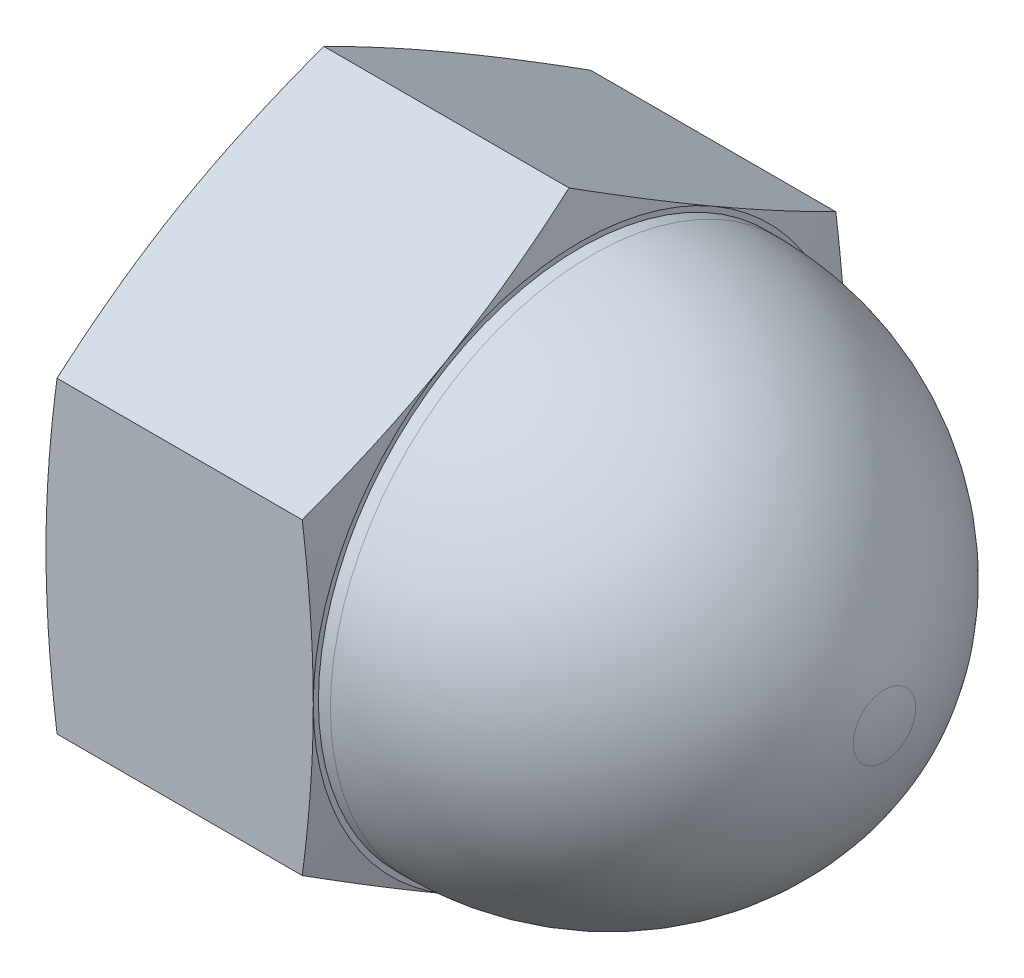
SolidWorks part; units mm, degrees
ref_plane "Plane1" through (0, 0, 0) normal (0, 0, 1) x (1, 0, 0)
ref_plane "Plane2" through (0, 0, 0) normal (0, 1, 0) x (1, 0, 0)
ref_plane "Plane3" through (0, 0, 0) normal (1, 0, 0) x (0, 0, -1)
sketch "BaseNutSke" plane through (0, 0, 0) normal (1, 0, 0) x (0, 0, -1)
  line L6 (18.2562, 10.5403) -> (18.2562, -10.5403)
  line L7 (-18.2562, 10.5403) -> (-18.2563, -10.5403)
  line L8 (18.2562, 10.5403) -> (0, 21.0805)
  line L9 (0, 21.0805) -> (-18.2562, 10.5403)
  line L10 (-18.2563, -10.5403) -> (0, -21.0805)
  line L11 (0, -21.0805) -> (18.2562, -10.5403)
  dimension "D4" = 60
  dimension "D1" = 120
  dimension "D2" = 18.2562
  dimension "D3" = 18.2562
  dimension "Width_flats" = 36.5125
extrude "BaseNut" add sketch "BaseNutSke" along normal blind 18.288
sketch "Sketch3" plane through (0, 0, 0) normal (0, 0, 1) x (1, 0, 0)
  line L0 (0, 0) -> (63.5, 0) construction
  line L1 (0, 10.5403) -> (0, -10.5403) construction
  line L2 (39.37, 0) -> (0, 0)
  line L3 (0, 17.907) -> (19.1115, 17.907)
  line L4 (0, -17.907) -> (22.225, -17.907) construction
  line L5 (0, 17.907) -> (0, 0)
  arc A0 (39.37, 0) -> (39.1176, 2.1336) centre (30.226, 0) ccw
  arc A1 (39.1176, 2.1336) -> (19.1115, 17.907) centre (19.1115, -2.667) ccw
  dimension "Nose_radius" = 9.144
  dimension "Body_radius" = 20.574
  dimension "Overall_ht" = 39.37
  dimension "Body_dia" = 35.814
revolve "Crown" add sketch "Sketch3" angle 360 about L0
sketch "Sketch4" plane through (0, 0, 0) normal (0, 0, 1) x (1, 0, 0)
  line L0 (0, 18.2562) -> (1.9554, 25.554)
  line L1 (18.288, 18.2562) -> (16.3329, 25.554)
  line L2 (1.9554, 25.554) -> (16.3329, 25.554)
  line L3 (18.288, 18.2562) -> (30.988, 18.2562)
  line L4 (30.988, 18.2562) -> (30.988, 43.6562)
  line L5 (30.988, 43.6562) -> (-12.7, 43.6562)
  line L6 (0, 18.2562) -> (-12.7, 18.2562)
  line L7 (-12.7, 18.2562) -> (-12.7, 43.6562)
  line L8 (18.288, 21.0805) -> (18.288, 10.5403) construction
  line L9 (0, 21.0805) -> (0, 10.5403) construction
  line L10 (0, 0) -> (57.15, 0) construction
  line L11 (18.288, 21.0805) -> (0, 21.0805) construction
  point P17 (18.288, 18.2562)
  dimension "D1" = 14.997
  dimension "D2" = 15
  dimension "D3" = 12.7
  dimension "D4" = 12.7
  dimension "D5" = 4.4735
  dimension "D6" = 25.4
  dimension "D7" = 18.2562
revolve "DoubleChamfer" cut sketch "Sketch4" angle 360 about L10
sketch "Sketch5" plane through (0, 0, 0) normal (0, 0, 1) x (1, 0, 0)
  line L0 (0, 0) -> (44.45, 0) construction
  line L1 (0, 11.1125) -> (28.448, 11.1125)
  line L2 (0, 15.8104) -> (0, 0) construction
  line L3 (28.448, 11.1125) -> (35.1251, 0)
  line L4 (0, 0) -> (63.5, 0) construction
  line L5 (35.1251, 0) -> (0, 0)
  line L6 (0, 0) -> (0, 11.1125)
  line L7 (28.448, -11.1125) -> (35.1251, 0) construction
  line L8 (0, -11.1125) -> (28.448, -11.1125) construction
  dimension "TPA" = 118
  dimension "Thread_min" = 22.225
  dimension "Drill_depth" = 28.448
revolve "TapDrill" cut sketch "Sketch5"
pattern_linear "ThdSchPat" [suppressed]
revolve "ThreadSchematic" cut sketch "ThdSchSke" angle 360 about L0
sketch "ThdSchSke" plane through (0, 0, 0) normal (0, 1, 0) x (1, 0, 0)
  line L0 (0.0381, 12.7) -> (-1.0735, 11.1125)
  line L1 (-1.0735, 11.1125) -> (-1.0735, 5.5563)
  line L2 (-1.0735, 5.5563) -> (1.1497, 5.5562)
  line L3 (1.1497, 5.5562) -> (1.1497, 11.1125)
  line L4 (1.1497, 11.1125) -> (0.0381, 12.7)
  line L5 (-38.1, 0) -> (3.175, 0) construction
  line L6 (0, 0) -> (-15.875, 0) construction
  line L7 (0, 0) -> (63.5, 0) construction
  line L9 (3.2131, 3.175) -> (3.2131, -3.175) construction
  dimension "D1" = 360
  dimension "VeeAngle" = 70
  dimension "SideAngle" = 55
  dimension "Thread_major" = 25.4
  dimension "Tap_drill" = 22.225
  dimension "OverCut" = 11.1125
  dimension "D2" = 1
  dimension "Advance" = 3.0395
  dimension "Num_threads" = 7
  dimension "D4" = 50
  dimension "Thread_depth" = 25.4
  dimension "Thread_nominal" = 25.4
sketch "EndChamferSketch" plane through (0, 0, 0) normal (0, 0, 1) x (1, 0, 0)
  line L0 (-0.0254, 12.7) -> (0.0254, 12.7)
  line L1 (0.0254, 12.7) -> (1.2481, 10.9538)
  line L2 (1.2481, 10.9538) -> (-0.0254, 10.9538)
  line L3 (-0.0254, 10.9538) -> (-0.0254, 12.7)
  line L4 (0, 0) -> (-15.875, 0) construction
  dimension "D1" = 0.0508
  dimension "D2" = 35
  dimension "D3" = 0.0254
  dimension "ChamferDepth" = 1.7463
  dimension "ThreadMajor" = 12.7
revolve "EndChamfer" cut sketch "EndChamferSketch" angle 360 about L4
equation "\"D2@BaseNutSke\" = \"Width_flats@BaseNutSke\" / 2"
equation "\"D3@BaseNutSke\" = \"Width_flats@BaseNutSke\" / 2"
equation "\"D7@Sketch4\" = \"Width_flats@BaseNutSke\" / 2"
equation "\"Thread_major@ThdSchSke\" = \"Thread_nominal@ThreadCosmetic\""
equation "\"Tap_drill@ThdSchSke\" = \"Thread_min@Sketch5\""
equation "\"Overcut@ThdSchSke\" = \"Tap_drill@ThdSchSke\" * 0.5"
equation "\"Num_threads@ThdSchPat\" = int(  ( \"Hex_ht@BaseNut\" - 0.002 ) / \"Advance@ThdSchSke\" + 0.999 )  + 1"
equation "\"Advance@ThdSchPat\" = ( \"Hex_ht@BaseNut\" - 0.002 ) /  (\"Num_threads@ThdSchPat\" - 1) 'relax it"
equation "' \"Num_threads@ThdSchPat\" = \"Num_threads@ThdSchPat\" - sgn( \"Num_threads@ThdSchPat\" - 1) '---chamfered tips only---"
equation "\"ThreadMajor@EndChamferSketch\" = \"Thread_nominal@ThreadCosmetic\" * 0.5"
equation "\"ChamferDepth@EndChamferSketch\" = (\"Thread_nominal@ThreadCosmetic\" - \"Thread_min@Sketch5\") * 0.55"
